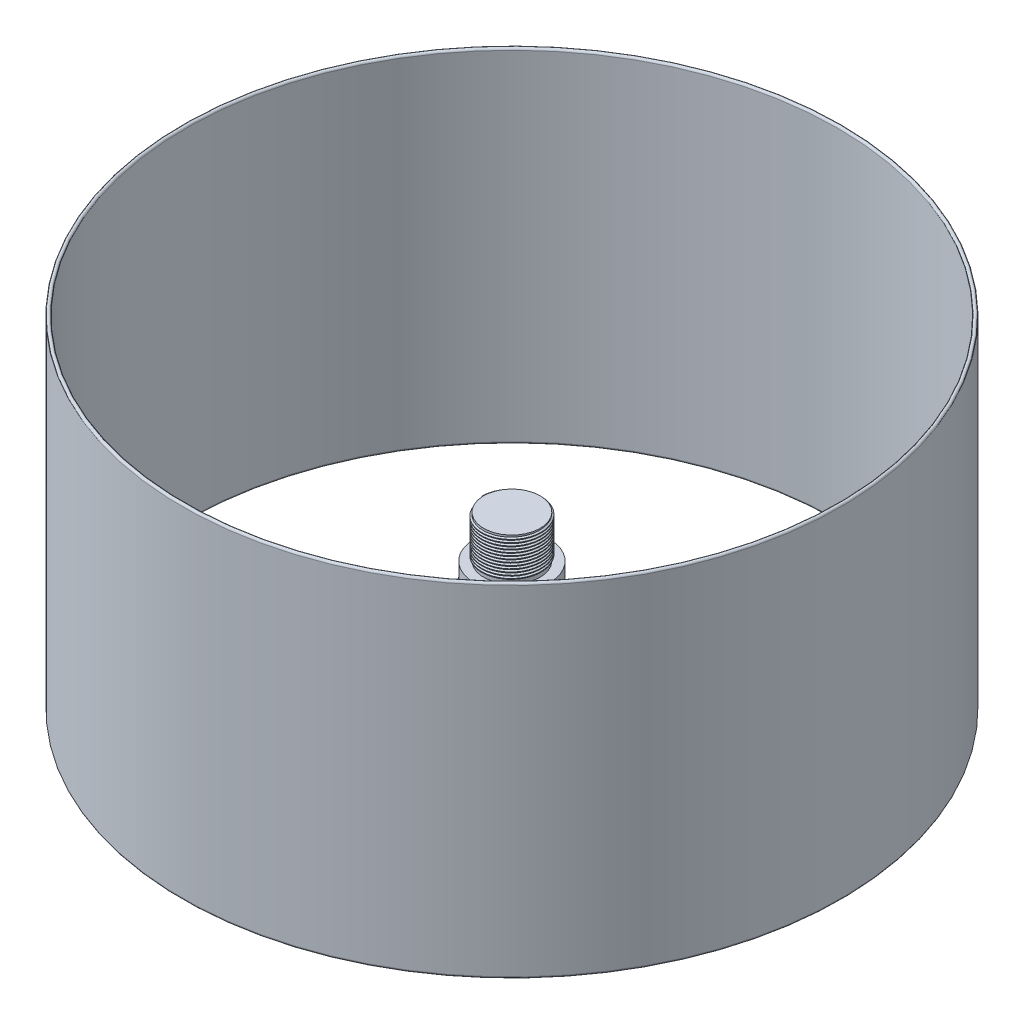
SolidWorks part; units mm, degrees
other "VistaExpl1" [suppressed]
other "Paso de explosión1" [suppressed]
other "Línea de explosión1"
ref_plane "Alzado" through (0, 0, 0) normal (0, 0, 1) x (1, 0, 0)
ref_plane "Planta" through (0, 0, 0) normal (0, 1, 0) x (1, 0, 0)
ref_plane "Vista lateral" through (0, 0, 0) normal (1, 0, 0) x (0, 0, -1)
sketch "Croquis11" plane through (0, 0, 0) normal (0, 0, 1) x (1, 0, 0)
  line L0 (0, 0) -> (-77.5, 0)
  line L1 (0, 285) -> (0, 0)
  line L2 (-70, 285) -> (-46.5693, 285)
  line L3 (-80, 275) -> (-80, 140.0244)
  line L4 (-70, 130.0244) -> (-50.7258, 130.0244)
  line L5 (-42.5, 295.3133) -> (-42.5, 285)
  line L7 (-47.1771, 130.0244) -> (-54.2747, 130.0244) construction
  line L8 (-42.5, 285) -> (0, 285)
  arc A1 (-80, 140.0244) -> (-70, 130.0244) centre (-70, 140.0244) ccw
  arc A2 (-80, 275) -> (-70, 285) centre (-70, 275) cw
  spline S0 degree 3 poles (-46.5693, 285) (-42.2586, 284.9957) (-42.5189, 290.0826) (-42.5, 295.3133) knots 0 0 0 0 1 1 1 1
  spline S1 degree 3 poles (-50.7258, 130.0244) (-47.7685, 130.0244) (-45.7736, 127.1563) (-47.1955, 121.8851) knots 0 0 0 0 1 1 1 1
  spline S2 degree 3 poles (-47.1955, 121.8851) (-63.3904, 70.3927) (-77.775, 9.7724) (-77.5, 0) knots 0 0 0 0 1 1 1 1
  dimension "D1" = 285
  dimension "D2" = 10
  dimension "D5" = 42.5
  dimension "D4" = 77.5
sketch "Croquis8" plane through (0, 0, 0) normal (0, 0, 1) x (1, 0, 0)
  line L0 (25, 513.3139) -> (25, 573.3139)
  line L1 (5, 550.8139) -> (10, 550.8139)
  line L2 (25, 573.3139) -> (10, 573.3139)
  line L3 (5, 550.8139) -> (5, 528.3139)
  line L4 (20, 513.3139) -> (25, 513.3139)
  line L5 (10, 550.8139) -> (10, 573.3139)
  line L6 (200, 483.3139) -> (200, 663.3139)
  line L7 (198, 611.8869) -> (198, 483.3139)
  line L8 (198, 663.3139) -> (198, 611.8869)
  arc A0 (5, 528.3139) -> (20, 513.3139) centre (20, 528.3139) ccw
  arc A1 (198, 483.3139) -> (200, 483.3139) centre (199, 483.3139) ccw
  arc A6 (200, 663.3139) -> (198, 663.3139) centre (199, 663.3139) ccw
  dimension "D2" = 175
  dimension "D3" = 30
  dimension "D4" = 180
  dimension "D5" = 2
revolve "Revolución4" add sketch "Croquis8" angle 360 about L0
sketch "Croquis9" plane through (0, 0, 0) normal (0, 0, 1) x (1, 0, 0)
  line L0 (-16.4997, 551.8139) -> (-4.0709, 551.8139)
  line L1 (-5.7645, 552.75) -> (-143.8325, 772.5434)
  line L2 (-145.5261, 773.4795) -> (-167.5731, 773.4795)
  line L3 (-169.2687, 774.4189) -> (-185.7013, 800.6896)
  line L4 (-187.3969, 801.629) -> (-198.1326, 801.629)
  line L5 (45, 550.8139) -> (5, 550.8139) construction
  arc A0 (-4.0709, 551.8139) -> (-5.7645, 552.75) centre (-4.0709, 553.8139) cw
  arc A1 (-143.8325, 772.5434) -> (-145.5261, 773.4795) centre (-145.5261, 771.4795) ccw
  arc A2 (-167.5731, 773.4795) -> (-169.2687, 774.4189) centre (-167.5731, 775.4795) cw
  arc A3 (-185.7013, 800.6896) -> (-187.3969, 801.629) centre (-187.3969, 799.629) ccw
  dimension "D1" = 2
  dimension "D2" = 1
ref_plane "Plano2" through (-16.4997, 551.8139, 0) normal (1, 0, 0) x (0, 0, -1)
sketch "Croquis10" plane through (-16.4997, 551.8139, 0) normal (1, 0, 0) x (0, 0, -1)
  circle A0 centre (0, 0) radius 1
revolve "Revolución5" add sketch "Croquis11" angle 360 about L1
sketch "Croquis12" plane through (0, 285, 0) normal (0, 1, 0) x (1, 0, 0)
  circle A0 centre (0, 0) radius 45
  circle A1 centre (0, 0) radius 48
extrude "Saliente-Extruir1" add sketch "Croquis12" along normal blind 40 separate body
sketch "Croquis13" plane through (0, 0, 0) normal (0, 0, 1) x (1, 0, 0)
  line L0 (0, 295.3154) -> (0, 510.3154)
  line L2 (0, 510.3154) -> (77.5, 510.3154)
  line L3 (77.5, 510.3154) -> (77.5, 475.3154)
  line L4 (77.5, 475.3154) -> (45.1722, 475.3154)
  line L5 (40, 293.2513) -> (40, 297.3795) construction
  line L6 (36.709, 475.3154) -> (49.1015, 475.3154) construction
  line L7 (80, 380.0177) -> (80, 429.1573) construction
  line L8 (40, 295.3154) -> (0, 295.3154)
  line L9 (40.2259, 299.3919) -> (40.2259, 340.2803) construction
  line L10 (40, 295.3154) -> (0, 295.3154)
  spline S0 degree 3 poles (45.1722, 475.3154) (29.4199, 475.3154) (81.1877, 432.6424) (79.6402, 389.0395) (39.5102, 333.5583) (40.5195, 297.1401) (40, 298.6138) (40, 295.3154) knots 0 0 0 0 0.35628 0.437456 0.770169 0.830583 1 1 1 1
  dimension "D1" = 215
  dimension "D2" = 35
  dimension "D3" = 77.5
  dimension "D5" = 40
revolve "Revolución6" add sketch "Croquis13" angle 360 about L0
sketch "Croquis14" plane through (0, 510.3154, 0) normal (0, 1, 0) x (1, 0, 0)
  circle A0 centre (0, 0) radius 80
extrude "Saliente-Extruir2" add sketch "Croquis14" along normal blind 3 separate body
sketch "Croquis15" plane through (0, 513.3154, 0) normal (0, 1, 0) x (1, 0, 0)
  circle A0 centre (25, 0) radius 6.5
sketch "Croquis16" plane through (0, 0, 0) normal (0, -1, 0) x (1, 0, 0)
  circle A0 centre (0, 0) radius 110
extrude "Saliente-Extruir4" add sketch "Croquis16" along normal blind 3 separate body
thread "Rosca1" pitch 1.5 start angle 0, offset 0, length 20, pitch 1.5, diameter 30
ref_plane "Plano3" through (10, 573.3139, 0) normal (0, 0, -1) x (1, 0, 0)
sketch "Perfil de rosca1" plane through (10, 573.3139, 0) normal (0, 0, -1) x (1, 0, 0)
  line L0 (0, 0) -> (0, 1.5) construction
  line L11 (0, 0) -> (0, 1.3125)
  line L12 (0, 1.3125) -> (-0.8119, 0.8437)
  line L13 (-0.8119, 0.8437) -> (-0.8119, 0.4687)
  line L15 (-0.8119, 0.4687) -> (0, 0)
  line L17 (-0.8119, 0.6562) -> (0, 0.6562) construction
  point P2 (0, 0)
  dimension "Pitch" = 1.5
  dimension "Profile_Angle" = 60
  dimension "Profile_Land" = 0.375
  dimension "Profile_Height" = 0.8119
sketch "Croquis19" plane through (0, 550.8139, 0) normal (0, 1, 0) x (1, 0, 0)
  circle A0 centre (0, 0) radius 20
  circle A1 centre (0, 0) radius 15
sketch "Croquis21" plane through (0, 0, 0) normal (1, 0, 0) x (0, 0, -1)
  line L0 (0, 513.3154) -> (250.7219, 513.3154)
  line L1 (80, 513.3154) -> (-80, 513.3154) construction
  line L2 (250.7219, 513.3154) -> (250.7219, -36.6028)
  line L3 (250.7219, -36.6028) -> (-193.4794, -36.6028)
  line L4 (-193.4794, -36.6028) -> (-193.4794, 513.3154)
  line L5 (-193.4794, 513.3154) -> (0, 513.3154)
extrude "Cortar-Extruir1" cut sketch "Croquis21" against normal mid plane 290
sketch "Croquis22" plane through (0, 513.3139, 0) normal (0, -1, 0) x (1, 0, 0)
  circle A0 centre (25, 0) radius 7
extrude "Saliente-Extruir7" add sketch "Croquis22" along normal blind 50
sketch "Croquis23" plane through (0, 463.3139, 0) normal (0, -1, 0) x (1, 0, 0)
  circle A0 centre (25, 0) radius 12.5
  dimension "D1" = 25
extrude "Saliente-Extruir8" add sketch "Croquis23" along normal blind 2
move or copy body "Sólido-Mover/Copiar1" [suppressed] bodies to move or copy 129 copy no translate (0, 163.5266, 0)
